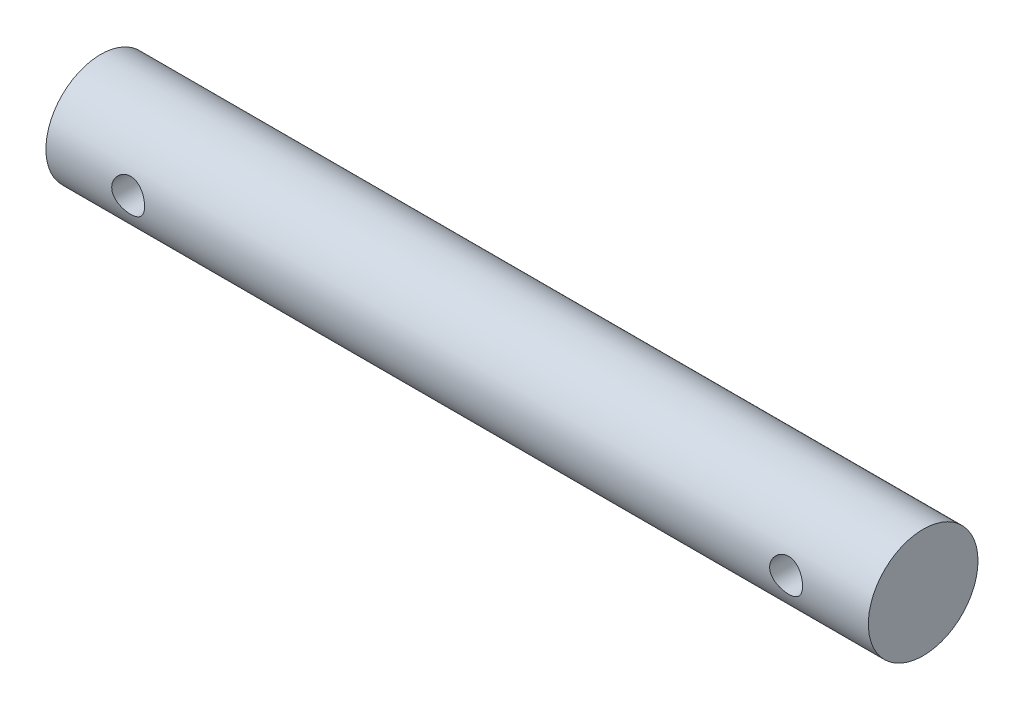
SolidWorks part; units mm, degrees
ref_plane "Längs" through (0, 0, 0) normal (0, 0, 1) x (1, 0, 0)
ref_plane "Oben" through (0, 0, 0) normal (0, 1, 0) x (1, 0, 0)
ref_plane "Quer" through (0, 0, 0) normal (1, 0, 0) x (0, 0, -1)
sketch "Skizze1" plane through (0, 0, 0) normal (1, 0, 0) x (0, 0, -1)
  circle A0 centre (0, 0) radius 20
  dimension "D1" = 40
extrude "Linear austragen1" add sketch "Skizze1" along normal mid plane 300
ref_plane "Ebene1" through (0, 0, -20) normal (0, 0, -1) x (0, -1, 0)
hole_wizard "Ø12.0 (12) Durchmesser Bohrung1" positions "Skizze3" profile "Skizze2" hole size "Ø12.0" standard "ISO_Wehrhahn"
sketch "Skizze3" plane through (0, 0, -20) normal (0, 0, -1) x (0, -1, 0)
  line L1 (0, 0) -> (0, -454.8185) construction
  line L3 (0, 0) -> (67.6172, 0) construction
  line L5 (-20, -150) -> (20, -150) construction
  point P1 (0, 120)
  point P3 (0, -120)
  dimension "D1" = 240
  dimension "D2" = 30
sketch "Skizze2" plane through (-120, 0, -20) normal (1, 0, 0) x (0, 1, 0)
  line L0 (0, 0) -> (0, 40)
  line L1 (0, 40) -> (6, 40)
  line L2 (6, 40) -> (6, 0)
  line L5 (6, 0) -> (0, 0)
  line L11 (0, -6.35) -> (0, 107.95) construction
  dimension "Bohrerdurchmesser" = 12
  dimension "Bohrungstiefe" = 40
